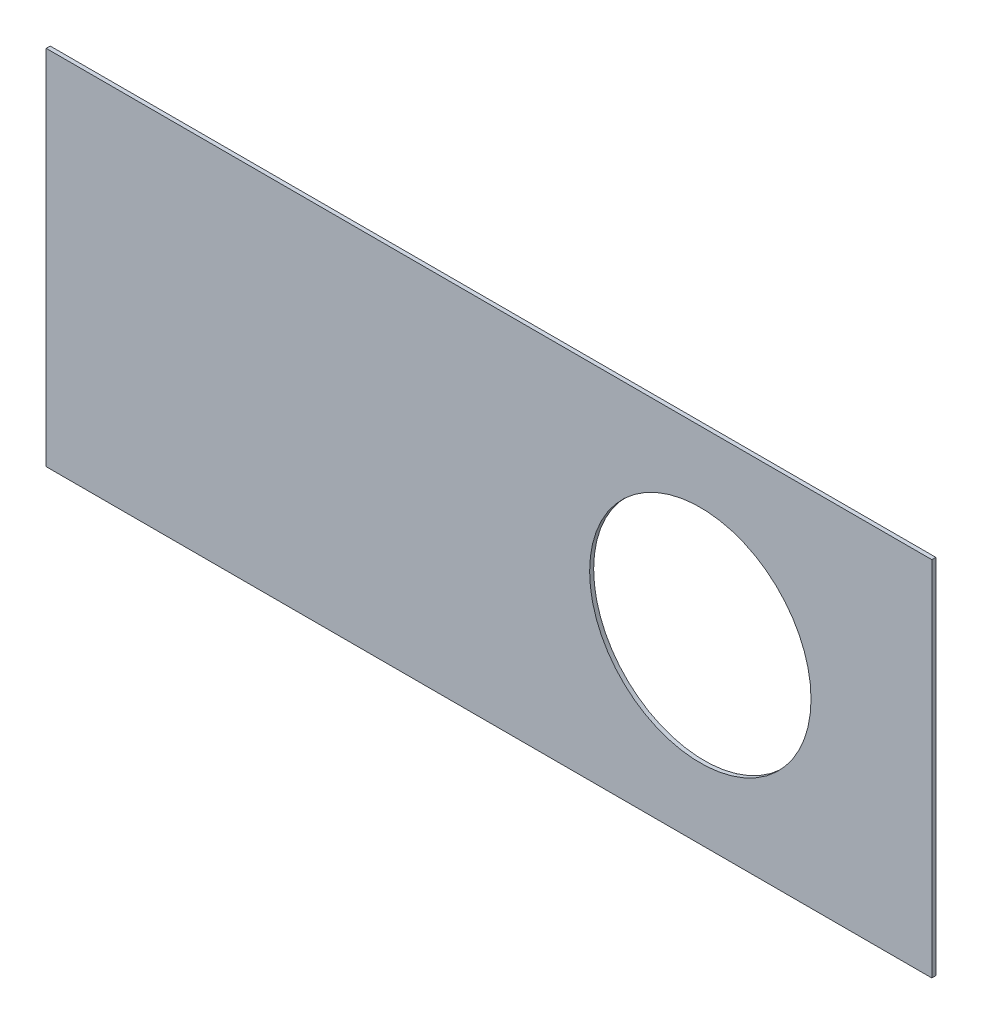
SolidWorks part; units mm, degrees
ref_plane "Plan de face" through (0, 0, 0) normal (0, 0, 1) x (1, 0, 0)
ref_plane "Plan de dessus" through (0, 0, 0) normal (0, 1, 0) x (1, 0, 0)
ref_plane "Plan de droite" through (0, 0, 0) normal (1, 0, 0) x (0, 0, -1)
sketch "Esquisse1" plane through (0, 0, 0) normal (0, 0, 1) x (1, 0, 0)
  line L1 (-151.5994, 47.8521) -> (68.4006, 47.8521)
  line L2 (-151.5994, 47.8521) -> (-151.5994, -42.1479)
  line L3 (-151.5994, -42.1479) -> (68.4006, -42.1479)
  line L4 (68.4006, 47.8521) -> (68.4006, -42.1479)
  circle A0 centre (10.9006, 2.8521) radius 27.5
  dimension "D3" = 55
  dimension "D4" = 45
  dimension "D1" = 90
  dimension "D2" = 162.5
  dimension "D5" = 220
extrude "Boss.-Extru.1" add sketch "Esquisse1" along normal blind 1
